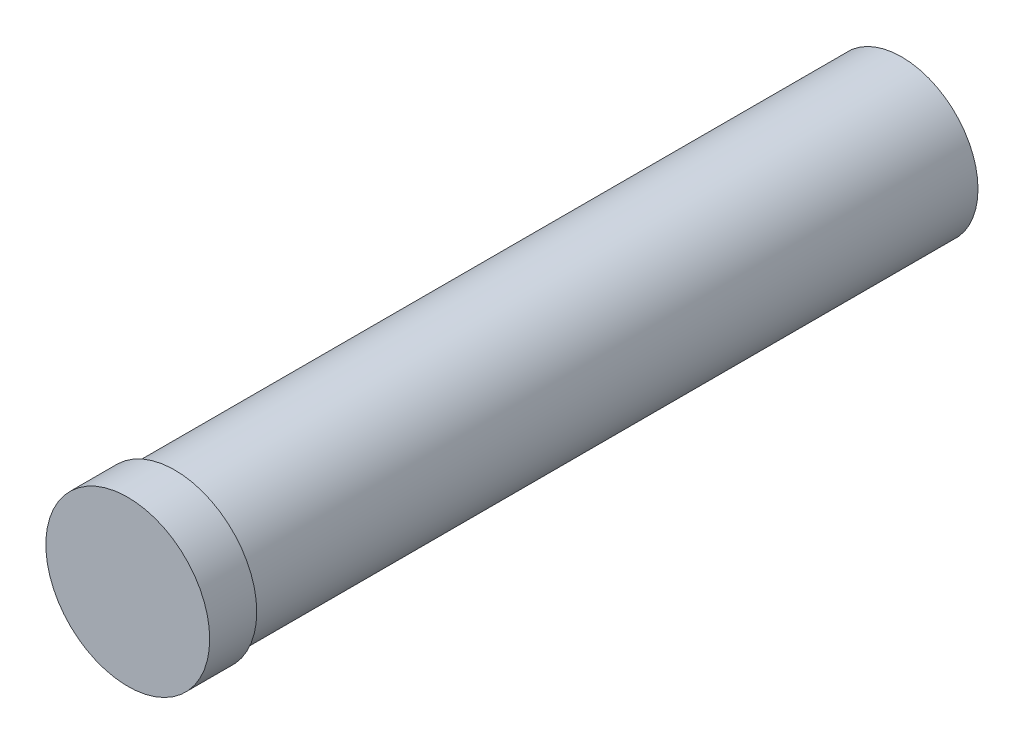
SolidWorks part; units mm, degrees
ref_plane "Plan de face" through (0, 0, 0) normal (0, 0, 1) x (1, 0, 0)
ref_plane "Plan de dessus" through (0, 0, 0) normal (0, 1, 0) x (1, 0, 0)
ref_plane "Plan de droite" through (0, 0, 0) normal (1, 0, 0) x (0, 0, -1)
sketch "Esquisse1" plane through (0, 0, 0) normal (0, 0, 1) x (1, 0, 0)
  circle A0 centre (0, 0) radius 91.25
  dimension "D1" = 182.5
extrude "Extrusion1" add sketch "Esquisse1" against normal blind 52.4
sketch "Esquisse2" plane through (0, 0, -52.4) normal (0, 0, -1) x (-1, 0, 0)
  circle A0 centre (0, 0) radius 85
  dimension "D1" = 170
extrude "Extrusion2" add sketch "Esquisse2" along normal blind 809.6
sketch "Esquisse3" plane through (0, 0, 0) normal (1, 0, 0) x (0, 0, -1)
  line L0 (0, 0) -> (521.7028, 0) construction
  line L1 (862, 0) -> (862, 77)
  line L2 (862, -85) -> (862, 85) construction
  line L3 (862, 77) -> (823, 77)
  line L4 (823, 77) -> (823, 74)
  line L5 (823, 74) -> (788, 74)
  line L6 (788, 74) -> (788, 70)
  line L7 (788, 70) -> (60, 70)
  line L8 (60, 70) -> (60, 0)
  line L9 (60, 0) -> (862, 0)
  line L10 (52.4, -91.25) -> (52.4, 91.25) construction
  dimension "D1" = 77
  dimension "D2" = 39
  dimension "D3" = 74
  dimension "D4" = 35
  dimension "D5" = 7.6
  dimension "D6" = 70
revolve "Enlèvement de matière-Révolution1" cut sketch "Esquisse3" angle 360 about L0
sketch "Esquisse4" plane through (0, 0, -862) normal (0, 0, -1) x (-1, 0, 0)
  point P0 (0, 0)
chamfer "Chanfrein1" distance 2 angle 45 1 edges at (77, 0, -862)
